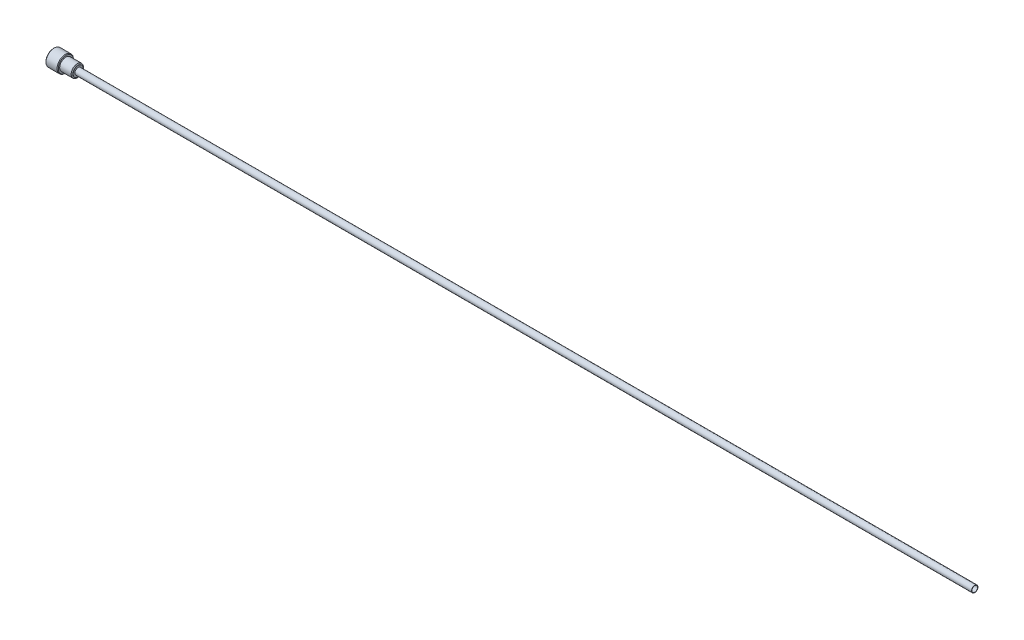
SolidWorks part; units mm, degrees
ref_plane "Front Plane" through (0, 0, 0) normal (0, 0, 1) x (1, 0, 0)
ref_plane "Top Plane" through (0, 0, 0) normal (0, 1, 0) x (1, 0, 0)
ref_plane "Right Plane" through (0, 0, 0) normal (1, 0, 0) x (0, 0, -1)
sketch "Sketch1" plane through (0, 0, 0) normal (0, 0, 1) x (1, 0, 0)
  line L1 (12, 2.44) -> (11.9, 2.44)
  line L2 (6, 3) -> (11.5767, 3)
  line L3 (6, 3) -> (6, 4)
  line L4 (12, 2.44) -> (12, 1.5875)
  line L5 (12, 1.5875) -> (450, 1.5875)
  line L6 (450, 1.5875) -> (450, 1.3843)
  line L7 (450, 1.3843) -> (0, 1.3843)
  line L8 (0, 1.3843) -> (0, 4)
  line L9 (-22.2122, 0) -> (63.2184, 0) construction
  line L11 (11.9, 2.44) -> (11.5767, 3)
  line L13 (6, 4) -> (0, 4)
  dimension "D2" = 6
  dimension "D1" = 6
  dimension "D3" = 12
  dimension "tube ID" = 2.7686
  dimension "D4" = 0.1
  dimension "D5" = 60
  dimension "D6" = 3.175
  dimension "D7" = 450
  dimension "D8" = 8
  dimension "D9" = 4.88
revolve "Revolve1" add sketch "Sketch1" angle 360 about L9
chamfer "Chamfer3" distance 0.3 angle 45 2 edges at (6, 0, 4) (0, 0, 4)
sketch "Sketch6" plane through (0, 0, 0) normal (0, 0, 1) x (1, 0, 0)
  line L0 (-8.2675, 0) -> (-13.3345, 0) construction
  line L1 (0, 0) -> (0, 2.5)
  line L3 (0, 2.5) -> (3.8, 2.5)
  line L4 (3.8, 2.5) -> (5.3022, 0)
  line L5 (5.3022, 0) -> (0, 0)
  dimension "D1" = 59
  dimension "D2" = 3.8
  dimension "D3" = 5
revolve "Cut-Revolve2" cut sketch "Sketch6" angle 360 about L0
chamfer "Chamfer2" distance 0.5 angle 45 1 edges at (0, 0, -2.5)
sketch "Sketch7" plane through (0, 0, 0) normal (-1, 0, 0) x (0, 0, 1)
  line L1 (-1.4434, 2.5) -> (-2.8868, 0)
  line L2 (-2.8868, 0) -> (-1.4434, -2.5)
  line L3 (-1.4434, -2.5) -> (1.4434, -2.5)
  line L4 (1.4434, -2.5) -> (2.8868, 0)
  line L5 (2.8868, 0) -> (1.4434, 2.5)
  line L6 (1.4434, 2.5) -> (-1.4434, 2.5)
  circle A0 centre (0, 0) radius 2.5 construction
  circle A1 centre (0, 0) radius 2.5 construction
extrude "Cut-Extrude1" cut sketch "Sketch7" against normal up to surface (3.5676 mm away)
